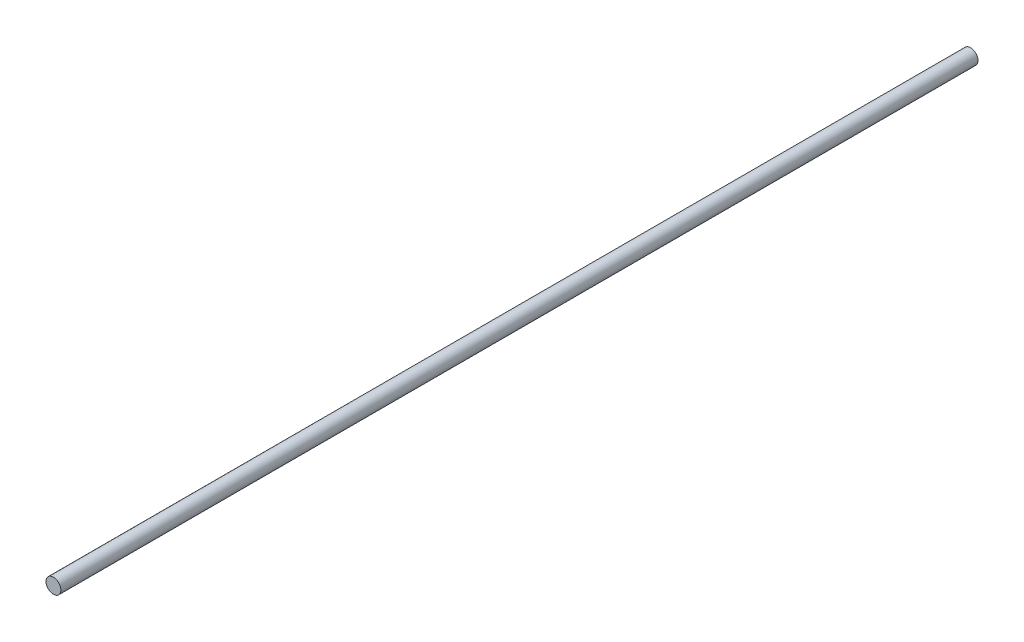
SolidWorks part; units mm, degrees
ref_plane "Front Plane" through (0, 0, 0) normal (0, 0, 1) x (1, 0, 0)
ref_plane "Top Plane" through (0, 0, 0) normal (0, 1, 0) x (1, 0, 0)
ref_plane "Right Plane" through (0, 0, 0) normal (1, 0, 0) x (0, 0, -1)
sketch "Sketch1" plane through (0, 0, 0) normal (0, 0, 1) x (1, 0, 0)
  circle A0 centre (0, 0) radius 30
  dimension "D1" = 60
extrude "Boss-Extrude1" add sketch "Sketch1" against normal blind 3700
